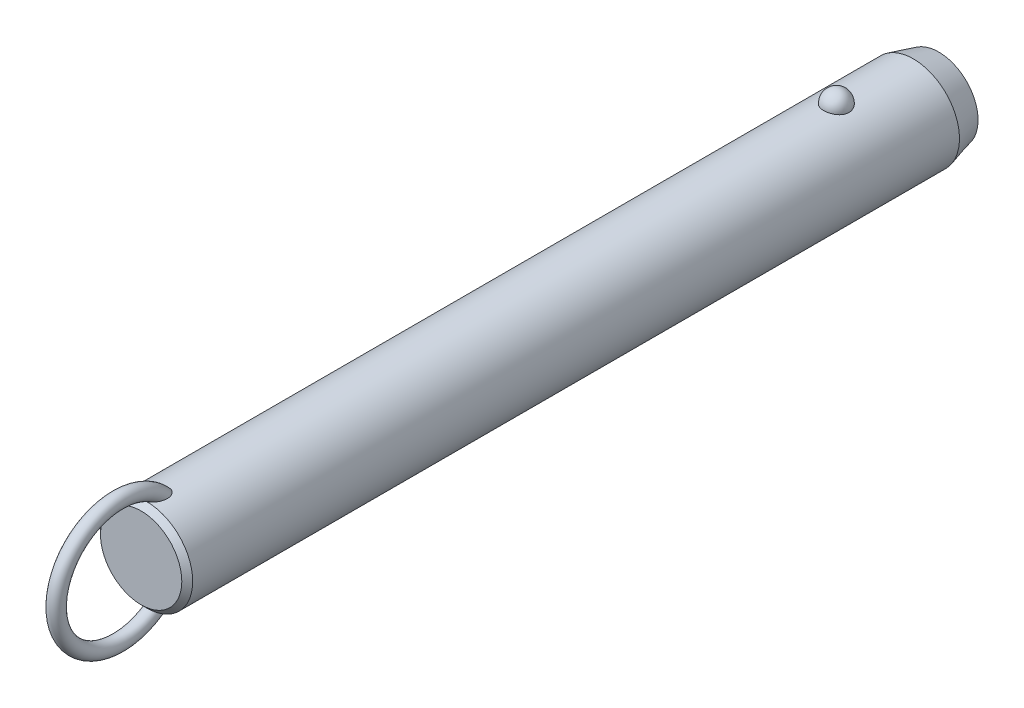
SolidWorks part; units mm, degrees
ref_plane "Front Plane" through (0, 0, 0) normal (0, 0, 1) x (1, 0, 0)
ref_plane "Top Plane" through (0, 0, 0) normal (0, 1, 0) x (1, 0, 0)
ref_plane "Right Plane" through (0, 0, 0) normal (1, 0, 0) x (0, 0, -1)
sketch "Sketch2" plane through (0, 0, 0) normal (0, 0, 1) x (1, 0, 0)
  circle A0 centre (0, 0) radius 12.7
  point P3 (0, 12.7)
  dimension "D1" = 25.4
extrude "Boss-Extrude1" add sketch "Sketch2" along normal blind 175.3
sketch "Sketch3" plane through (0, 0, 0) normal (0, 0, -1) x (-1, 0, 0)
  circle A0 centre (0, 0) radius 12.7
  dimension "D1" = 25.4
extrude "Boss-Extrude2" add sketch "Sketch3" along normal blind 31.7
chamfer "Chamfer1" distance 7 angle 15 1 edges at (-12.7, 0, -31.7)
sketch "Sketch12" plane through (0, 0, 0) normal (1, 0, 0) x (0, 0, -1)
  line L0 (-175.3, 12.7) -> (-175.3, -12.7) construction
  point P0 (-175.3, 0)
sketch "Sketch13" plane through (0, 0, 0) normal (1, 0, 0) x (0, 0, -1)
  circle A0 centre (-194.35, 0) radius 19.05
  point P2 (-175.3, 0)
  dimension "D1" = 38.1
sketch "Sketch14" plane through (0, 0, 0) normal (0, 1, 0) x (1, 0, 0)
  circle A0 centre (0, -177.3) radius 2
  point P2 (0, -175.3)
  dimension "D1" = 4
sweep "Sweep1" add profiles "Sketch14" path "Sketch13"
sketch "Sketch15" plane through (0, 0, 175.3) normal (0, 0, 1) x (1, 0, 0)
  circle A0 centre (0, 0) radius 12.7
  dimension "D1" = 25.4
extrude "Boss-Extrude3" add sketch "Sketch15" along normal blind 12.7
chamfer "Chamfer2" distance 1.5 angle 45 1 edges at (12.7, 0, 188)
sketch "Sketch18" plane through (0, 0, 0) normal (1, 0, 0) x (0, 0, -1)
  line L0 (24.7, 12.7) -> (-180.151, 12.7) construction
  line L1 (3.5, 16.2) -> (3.5, 9.2)
  line L2 (-180.151, -12.7) -> (24.7, -12.7) construction
  arc A0 (3.5, 16.2) -> (3.5, 9.2) centre (3.5, 12.7) ccw
  point P4 (0, 12.7)
  dimension "D1" = 28.9
revolve "Revolve1" add sketch "Sketch18" angle 360 about L1
